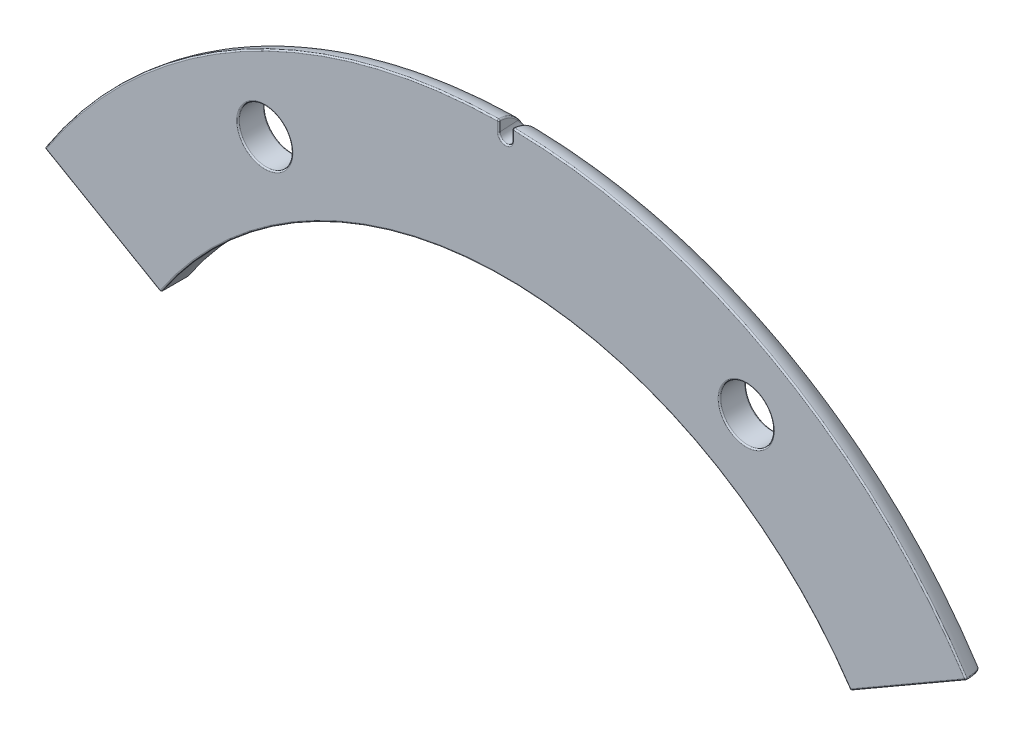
SolidWorks part; units mm, degrees
ref_plane "Спереди" through (0, 0, 0) normal (0, 0, 1) x (1, 0, 0)
ref_plane "Сверху" through (0, 0, 0) normal (0, 1, 0) x (1, 0, 0)
ref_plane "Справа" through (0, 0, 0) normal (1, 0, 0) x (0, 0, -1)
sketch "Эскиз1" plane through (0, 0, 0) normal (0, 0, 1) x (1, 0, 0)
  line L0 (0, 0) -> (0, 205) construction
  line L1 (0, 0) -> (177.5352, 102.5) construction
  line L2 (0, 0) -> (-177.5352, 102.5) construction
  line L3 (-128.9543, 85.9988) -> (-172.3239, 111.0382)
  line L4 (128.9543, 85.9988) -> (172.3239, 111.0382)
  line L5 (0, 0) -> (90, 155.8846) construction
  line L6 (0, 0) -> (-90, 155.8846) construction
  arc A0 (172.3239, 111.0382) -> (-172.3239, 111.0382) centre (0, 0) ccw
  arc A1 (128.9543, 85.9988) -> (-128.9543, 85.9988) centre (0, 0) ccw
  circle A2 centre (0, 0) radius 205 construction
  circle A3 centre (0, 0) radius 155 construction
  arc A4 (150.6438, 98.5213) -> (-150.6438, 98.5213) centre (0, 0) ccw construction
  arc A5 (151.3088, 97.497) -> (-151.3088, 97.497) centre (0, 0) ccw construction
  circle A6 centre (-90, 155.8846) radius 10
  circle A7 centre (90, 155.8846) radius 10
  dimension "D1" = 410
  dimension "D8" = 20
  dimension "D3" = 60
  dimension "D4" = 120
  dimension "D5" = 10
  dimension "D6" = 10
  dimension "D9" = 30
  dimension "D10" = 60
  dimension "D2" = 50
  dimension "D7" = 25
extrude "Бобышка-Вытянуть1" add sketch "Эскиз1" along normal mid plane 10
fillet "Скругление1" radius 10 1 edges at (0, 205, -5)
fillet "Скругление2" radius 0.5 14 edges at (-128.9543, 85.9988, 0) (-146.3035, 96.0154, -5) (-170.4278, 109.9435, -1.2413) (128.9543, 85.9988, 0) (169.0748, 109.1624, -2.8039) (146.3035, 96.0154, -5) (-150.6391, 98.5185, 5) (0, 205, 5) (150.6391, 98.5185, 5) (0, 155, 5) (100, 155.8846, -5) (100, 155.8846, 5) (-80, 155.8846, -5) (-80, 155.8846, 5)
sketch "Эскиз2" plane through (0, 0, 0) normal (1, 0, 0) x (0, 0, -1)
  line L4 (-7, 201) -> (5, 201) construction
  line L5 (5, 201) -> (5, 198) construction
  line L6 (5, 198) -> (-7, 198.6) construction
  line L7 (-7, 198.6) -> (-7, 201) construction
  line L8 (-7, 201) -> (5, 201)
  line L9 (5, 201) -> (5, 198)
  line L10 (5, 198) -> (-7, 198.6)
  line L11 (-7, 198.6) -> (-7, 201)
revolve "Вырез-Повернуть1" cut sketch "Эскиз2" angle 360 about L8
ref_plane "Плоскость1" through (0, 201, 0) normal (0, 1, 0) x (-1, 0, 0)
sketch "Эскиз4" plane through (0, 201, 0) normal (0, 1, 0) x (-1, 0, 0)
  line L0 (2.4, 7) -> (3, -5) construction
  line L1 (-3, -5) -> (3, -5) construction
  line L2 (-2.4, 7) -> (-3, -5) construction
  line L3 (2.4, 7) -> (-2.4, 7) construction
  line L4 (2.4, 7) -> (3, -5)
  line L5 (-3, -5) -> (3, -5)
  line L6 (-2.4, 7) -> (-3, -5)
  line L7 (2.4, 7) -> (-2.4, 7)
extrude "Вырез-Вытянуть2" cut sketch "Эскиз4" along normal through all
fillet "Скругление3" radius 0.5 8 edges at (-2.5065, 204.8082, 4.8697) (-2.5, 202.7358, 5) (0, 198.5, 5) (2.5, 202.7358, 5) (2.5104, 204.8777, 4.7914) (2.7769, 203.3069, -0.5389) (-0.2128, 203.7351, 0.1322) (-2.6638, 204.4307, 1.7236)
